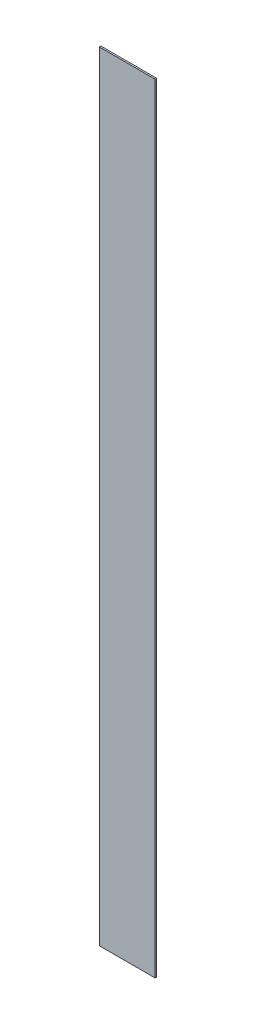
SolidWorks part; units mm, degrees
ref_plane "Спереди" through (0, 0, 0) normal (0, 0, 1) x (1, 0, 0)
ref_plane "Сверху" through (0, 0, 0) normal (0, 1, 0) x (1, 0, 0)
ref_plane "Справа" through (0, 0, 0) normal (1, 0, 0) x (0, 0, -1)
sketch "Эскиз1" plane through (0, 0, 0) normal (0, 0, 1) x (1, 0, 0)
  line L0 (-50, -184.8) -> (-50, -169.8) construction
  line L1 (-71, -184.8) -> (-29, -184.8)
  line L2 (-71, -184.8) -> (-71, 400.2)
  line L3 (-71, 400.2) -> (-29, 400.2)
  line L4 (-29, -184.8) -> (-29, 400.2)
  line L6 (-89.8, -184.8) -> (-77.7, -184.8) construction
  line L7 (-77.7, 400.2) -> (-89.8, 400.2) construction
  circle A0 centre (-50, -169.8) radius 2.25 construction
  dimension "D1" = 42
sheet metal parameters "Листовой металл1" thickness 1.2 parameters "D1"=1
base flange "Базовая кромка1" sketch "Эскиз1" thickness 1.2 reverse thickness direction yes parameters "D1"=1
extrude "Вырез-Вытянуть2" cut sketch "Эскиз5" against normal through all both and the other way through all
sketch "Эскиз5" plane through (0, 0, 1.2) normal (0, 0, 1) x (1, 0, 0)
  circle A3 centre (-49.2, 395) radius 1.5
  circle A4 centre (-49.2, -181.2) radius 1.5
flat pattern "Развертка1"
sketch "Сгиб-Линии1" plane through (0, 0, 0) normal (0, 1, 0) x (1, 0, 0)
sketch3d "Граничная рамка1" [suppressed]
  line L0 (29, 400.2, 0) -> (29, -184.8, 0) construction
  line L1 (71, 400.2, 0) -> (71, -184.8, 0) construction
  line L2 (29, 400.2, 0) -> (71, 400.2, 0) construction
  line L3 (29, -184.8, 0) -> (71, -184.8, 0) construction
